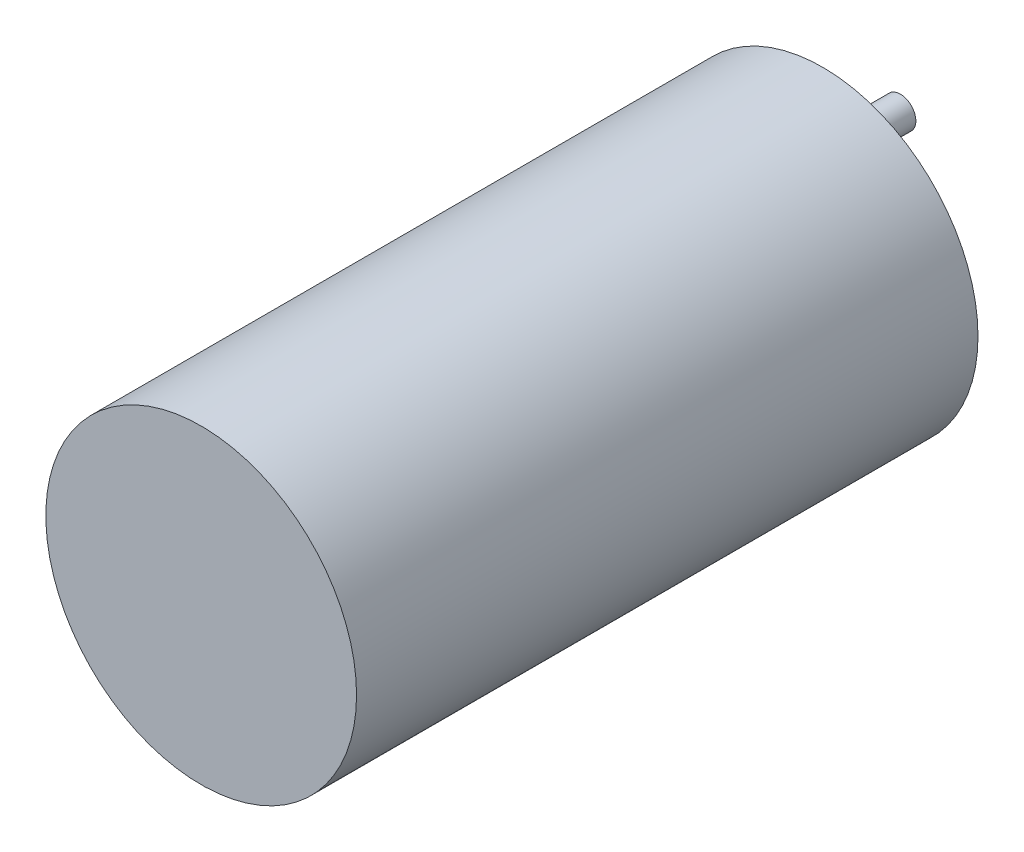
SolidWorks part; units mm, degrees
ref_plane "Спереди" through (0, 0, 0) normal (0, 0, 1) x (1, 0, 0)
ref_plane "Сверху" through (0, 0, 0) normal (0, 1, 0) x (1, 0, 0)
ref_plane "Справа" through (0, 0, 0) normal (1, 0, 0) x (0, 0, -1)
sketch "Эскиз1" plane through (0, 0, 0) normal (0, 0, 1) x (1, 0, 0)
  circle A0 centre (0, 0) radius 5.08
extrude "Бобышка-Вытянуть1" add sketch "Эскиз1" along normal blind 20.32
sketch "Эскиз2" plane through (0, 0, 0) normal (0, 0, -1) x (-1, 0, 0)
  circle A0 centre (0, 2.54) radius 0.508
  circle A1 centre (0, -2.54) radius 0.508
extrude "Бобышка-Вытянуть2" add sketch "Эскиз2" along normal blind 2.54
